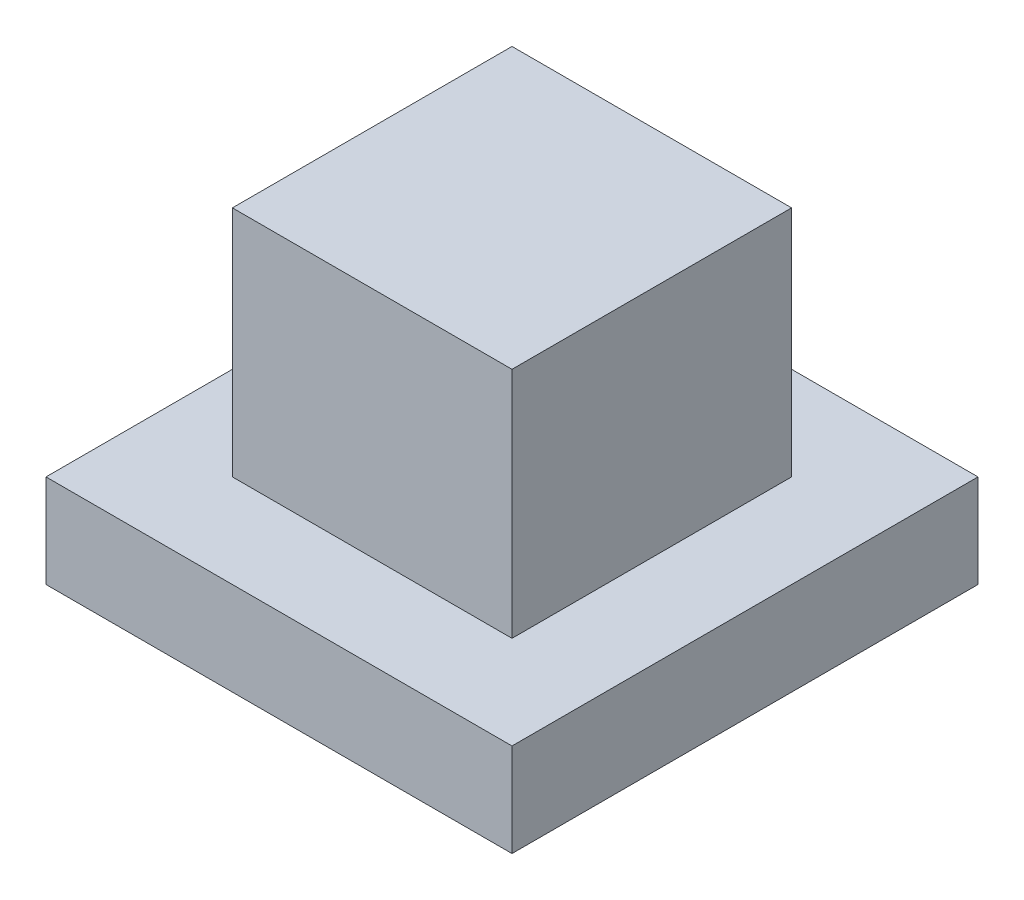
SolidWorks part; units mm, degrees
ref_plane "Front Plane" through (0, 0, 0) normal (0, 0, 1) x (1, 0, 0)
ref_plane "Top Plane" through (0, 0, 0) normal (0, 1, 0) x (1, 0, 0)
ref_plane "Right Plane" through (0, 0, 0) normal (1, 0, 0) x (0, 0, -1)
sketch "Sketch1" plane through (0, 0, 0) normal (0, 0, 1) x (1, 0, 0)
  line L1 (-50, -10) -> (50, -10)
  line L2 (-50, -10) -> (-50, 10)
  line L3 (-50, 10) -> (50, 10)
  line L4 (50, -10) -> (50, 10)
  line L5 (-50, -10) -> (50, 10) construction
  line L6 (-50, 10) -> (50, -10) construction
  point P0 (0, 0)
  dimension "D1" = 20
  dimension "D2" = 100
extrude "Boss-Extrude1" add sketch "Sketch1" along normal mid plane 100
sketch "Sketch2" plane through (0, 10, 0) normal (0, 1, 0) x (1, 0, 0)
  line L1 (-30, -30) -> (30, -30)
  line L2 (-30, -30) -> (-30, 30)
  line L3 (-30, 30) -> (30, 30)
  line L4 (30, -30) -> (30, 30)
  line L5 (-30, -30) -> (30, 30) construction
  line L6 (-30, 30) -> (30, -30) construction
  point P0 (0, 0)
  dimension "D1" = 60
  dimension "D2" = 60
extrude "Boss-Extrude2" add sketch "Sketch2" along normal blind 50
